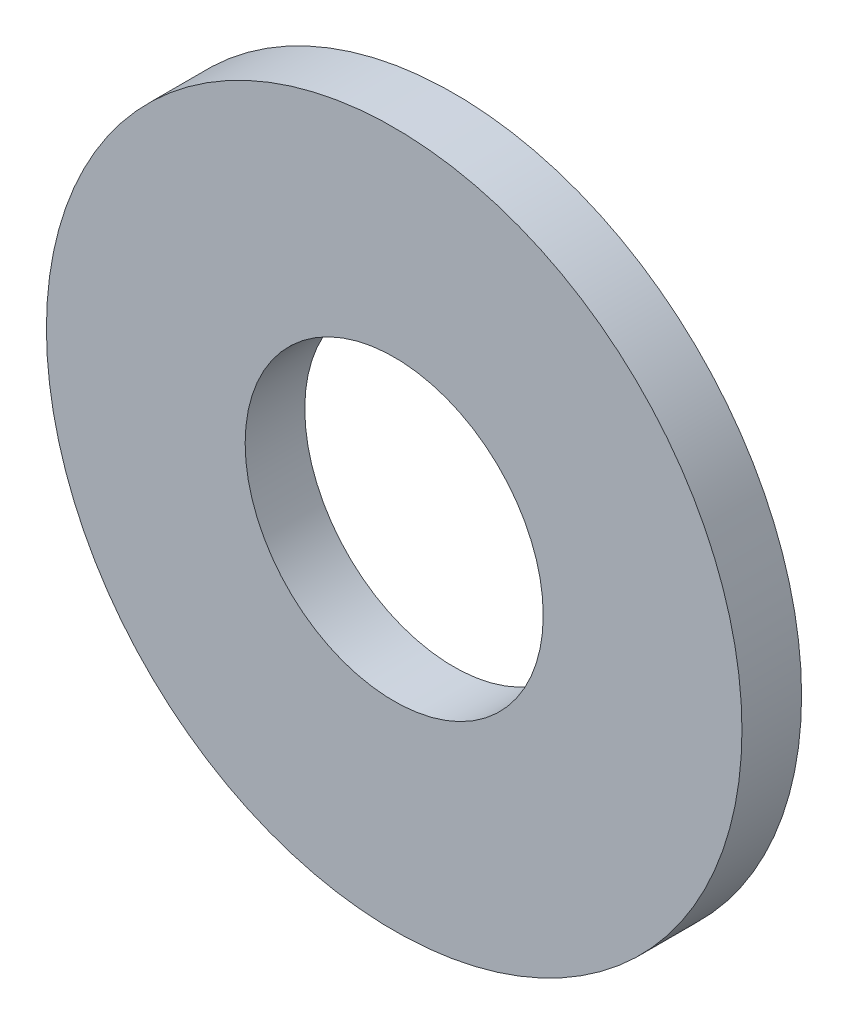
SolidWorks part; units mm, degrees
ref_plane "Front Plane" through (0, 0, 0) normal (0, 0, 1) x (1, 0, 0)
ref_plane "Top Plane" through (0, 0, 0) normal (0, 1, 0) x (1, 0, 0)
ref_plane "Right Plane" through (0, 0, 0) normal (1, 0, 0) x (0, 0, -1)
sketch "Sketch1" plane through (0, 0, 0) normal (0, 0, 1) x (1, 0, 0)
  circle A0 centre (0, 0) radius 1.5
  circle A1 centre (0, 0) radius 3.5
  dimension "D1" = 3
  dimension "D2" = 7
extrude "Boss-Extrude1" add sketch "Sketch1" along normal blind 0.6
